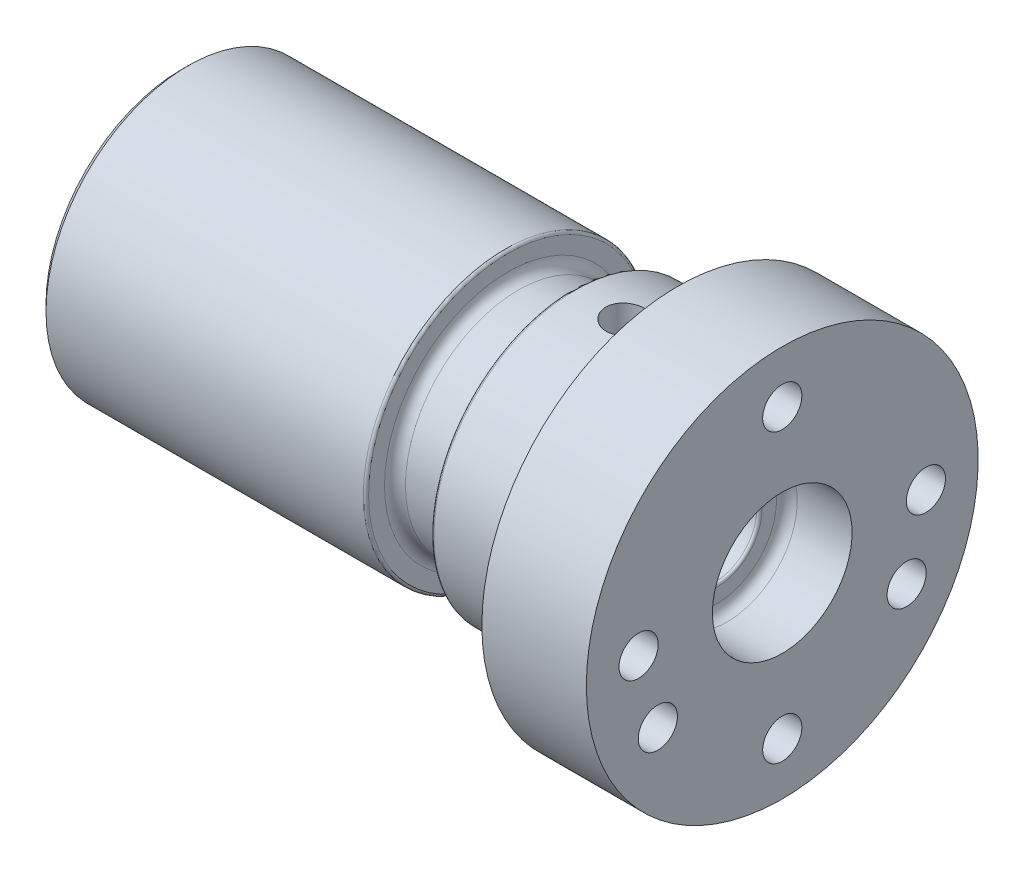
SolidWorks part; units mm, degrees
ref_plane "Plane1" through (0, 0, 0) normal (0, 0, 1) x (1, 0, 0)
ref_plane "Plane2" through (0, 0, 0) normal (0, 1, 0) x (1, 0, 0)
ref_plane "Plane3" through (0, 0, 0) normal (1, 0, 0) x (0, 0, -1)
sketch "Sketch1" plane through (0, 0, 0) normal (0, 0, 1) x (1, 0, 0)
  line L0 (0, 0) -> (60, 0) construction
  line L1 (41, 3.25) -> (31.5, 3.25)
  line L3 (41, 3.25) -> (41, 5.35)
  line L4 (31.5, 3.25) -> (31.5, 6)
  line L6 (0, 6) -> (0, 10.875)
  line L7 (41, 5.35) -> (46, 5.35)
  line L10 (25, 8.655) -> (30, 8.655)
  line L13 (25, 10.875) -> (25, 8.655)
  line L15 (30, 8.655) -> (30, 10.875)
  line L16 (30, 10.875) -> (38, 10.875)
  line L22 (0, 10.875) -> (25, 10.875)
  line L23 (38, 10.875) -> (38, 15)
  line L24 (38, 15) -> (46, 15)
  line L25 (46, 15) -> (46, 5.35)
  line L26 (31.5, 6) -> (0, 6)
  dimension "D2" = 10.7
  dimension "D3" = 6.5
  dimension "D4" = 5
  dimension "D5" = 8
  dimension "D6" = 2.22
  dimension "D7" = 5
  dimension "D8" = 25
  dimension "D11" = 21.75
  dimension "D12" = 8
  dimension "D13" = 30
  dimension "D14" = 12
  dimension "D15" = 31.5
revolve "Base-Revolve" add sketch "Sketch1" angle 360 about L0
chamfer "Chamfer1" distance 0.5 angle 45 1 edges at (0, 0, 10.875)
ref_plane "Plane4" through (0, 11.125, 0) normal (0, 1, 0) x (-1, 0, 0)
hole_wizard "M3.0 (3.000000) Diameter Hole1" positions "Sketch6" profile "Sketch5" hole size "M3.0" standard "Ansi Metric"
sketch "Sketch6" plane through (0, 11.125, 0) normal (0, 1, 0) x (-1, 0, 0)
  line L0 (0, 0) -> (-60, 0) construction
  line L1 (-38, -15) -> (-38, 15) construction
  point P0 (-34, 0)
  dimension "D1" = 4
sketch "Sketch5" plane through (34, 11.125, 0) normal (1, 0, 0) x (0, 0, 1)
  line L0 (0, 0) -> (0, 5.9013)
  line L1 (0, 5.9013) -> (1.5, 5)
  line L2 (1.5, 5) -> (1.5, 0)
  line L5 (1.5, 0) -> (0, 0)
  line L10 (0, 5.9013) -> (-1.5, 5) construction
  line L11 (0, -6.35) -> (0, 107.95) construction
  dimension "Hole Dia." = 3
  dimension "Hole Depth" = 5
  dimension "Drill Angle" = 118
fillet "Fillet1" radius 0.8 2 edges at (30, 0, 8.655) (25, 0, 8.655)
fillet "Fillet2" radius 0.2 2 edges at (30, 0, 10.875) (25, 0, 10.875)
hole_wizard "M3.0 (3.000000) Diameter Hole2" positions "Sketch8" profile "Sketch7" hole size "M3.0" standard "Ansi Metric"
sketch "Sketch8" plane through (46, 0, 0) normal (1, 0, 0) x (0, 0, -1)
  line L0 (0, 6.125) -> (0, 10.7711) construction
  point P0 (0, 11)
  dimension "D1" = 11
sketch "Sketch7" plane through (46, 11, 0) normal (0, 1, 0) x (0, 0, -1)
  line L0 (0, 0) -> (0, 6.9013)
  line L1 (0, 6.9013) -> (1.5, 6)
  line L2 (1.5, 6) -> (1.5, 0)
  line L5 (1.5, 0) -> (0, 0)
  line L10 (0, 6.9013) -> (-1.5, 6) construction
  line L11 (0, -6.35) -> (0, 107.95) construction
  dimension "Hole Dia." = 3
  dimension "Hole Depth" = 6
  dimension "Drill Angle" = 118
pattern_circular "CirPattern1" count 2 over 360 about axis through (0, 0, 0) along (1, 0, 0) of "M3.0 (3.000000) Diameter Hole1"
pattern_circular "CirPattern2" count 3 over 360 about axis through (0, 0, 0) along (1, 0, 0) of "M3.0 (3.000000) Diameter Hole2"
fillet "Fillet3" radius 0.8 1 edges at (41, 0, 5.35)
fillet "Fillet4" radius 0.2 1 edges at (41, 0, 3.25)
sketch "Sketch9" plane through (0, 0, 0) normal (-1, 0, 0) x (0, 0, 1)
  line L0 (0, 7.55) -> (0, 0) construction
  line L1 (-1.525, 7.55) -> (1.525, 7.55)
  line L2 (-1.525, 7.55) -> (-1.525, 3.5)
  line L3 (-1.525, 3.5) -> (1.525, 3.5)
  line L4 (1.525, 7.55) -> (1.525, 3.5)
  dimension "D1" = 7.55
  dimension "D2" = 3.05
  dimension "D3" = 3.5
extrude "Cut-Extrude1" cut sketch "Sketch9" against normal blind 23
fillet "Fillet5" [suppressed] radius 1.5
hole_wizard "M3.0 (3.000000) Diameter Hole3" positions "Sketch13" profile "Sketch12" hole size "M3.0" standard "Ansi Metric"
sketch "Sketch13" plane through (46, 0, 0) normal (1, 0, 0) x (0, 0, -1)
  line L0 (0, 11) -> (0, 0) construction
  point P0 (0, 11)
  dimension "D1" = 11
sketch "Sketch12" plane through (46, 11, 0) normal (0, 1, 0) x (0, 0, -1)
  line L0 (0, 0) -> (0, 6.9013)
  line L1 (0, 6.9013) -> (1.5, 6)
  line L2 (1.5, 6) -> (1.5, 0)
  line L5 (1.5, 0) -> (0, 0)
  line L10 (0, 6.9013) -> (-1.5, 6) construction
  line L11 (0, -6.35) -> (0, 107.95) construction
  dimension "Hole Dia." = 3
  dimension "Hole Depth" = 6
  dimension "Drill Angle" = 118
pattern_circular "CirPattern3" count 4 over 360 about axis through (0, 0, 0) along (1, 0, 0) of "M3.0 (3.000000) Diameter Hole3"
sketch "Sketch14" plane through (0, 0, 0) normal (0, 0, 1) x (1, 0, 0)
  line L1 (-4.8871, 16.366) -> (47.9702, 16.366)
  line L2 (-4.8871, 16.366) -> (-4.8871, -16.9162)
  line L3 (-4.8871, -16.9162) -> (47.9702, -16.9162)
  line L4 (47.9702, 16.366) -> (47.9702, -16.9162)
extrude "Cut-Extrude2" [suppressed] cut sketch "Sketch14" against normal blind 17
